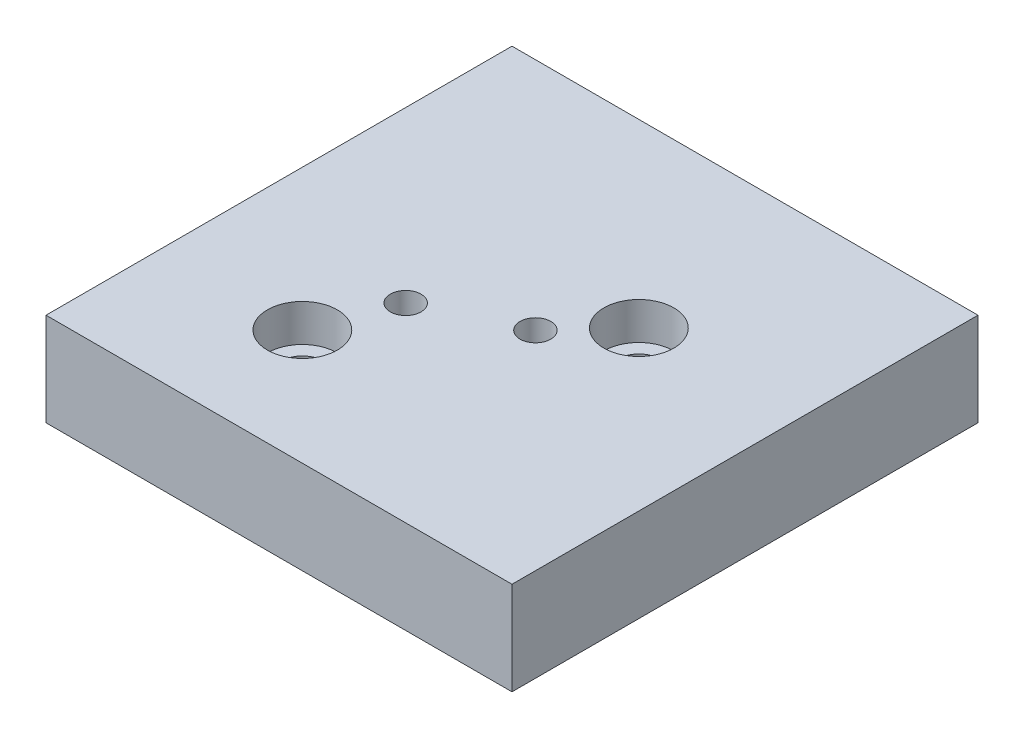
SolidWorks part; units mm, degrees
ref_plane "Vorne" through (0, 0, 0) normal (0, 0, 1) x (1, 0, 0)
ref_plane "Oben" through (0, 0, 0) normal (0, 1, 0) x (1, 0, 0)
ref_plane "Rechts" through (0, 0, 0) normal (1, 0, 0) x (0, 0, -1)
sketch "Skizze1" plane through (0, 0, 0) normal (0, 1, 0) x (1, 0, 0)
  line L1 (0, 0) -> (100, 0)
  line L2 (0, 0) -> (0, 100)
  line L3 (0, 100) -> (100, 100)
  line L4 (100, 0) -> (100, 100)
  dimension "D1" = 100
  dimension "D2" = 100
extrude "Linear austragen1" add sketch "Skizze1" along normal blind 20
hole_wizard "Durchgangsloch für M61" positions "Skizze3" profile "Skizze2" hole size "M6" standard "DIN"
sketch "Skizze3" plane through (0, 20, 0) normal (0, 1, 0) x (-1, 0, 0)
  point P0 (-55.3211, -49.7092)
  point P1 (-36.3268, -40.8565)
sketch "Skizze2" plane through (55.3211, 20, -49.7092) normal (1, 0, 0) x (0, 0, 1)
  line L0 (0, 0) -> (0, 20)
  line L1 (0, 20) -> (3.3, 20)
  line L2 (3.3, 20) -> (3.3, 0)
  line L5 (3.3, 0) -> (0, 0)
  line L11 (0, -6.35) -> (0, 107.95) construction
  dimension "Bohrerdurchmesser" = 6.6
  dimension "Bohrungstiefe" = 20
hole_wizard "Stirnsenkung für M8 Zylinderschraube mit Innensechskant2" positions "Skizze6" profile "Skizze5" counterbore size "M8" standard "DIN"
sketch "Skizze6" plane through (0, 20, 0) normal (0, 1, 0) x (-1, 0, 0)
  point P0 (-30.2529, -24.7592)
sketch "Skizze5" plane through (30.2529, 20, -24.7592) normal (1, 0, 0) x (0, 0, 1)
  line L0 (0, 0) -> (0, 20)
  line L1 (0, 20) -> (4.5, 20)
  line L3 (4.5, 20) -> (4.5, 8)
  line L4 (4.5, 8) -> (7.5, 8)
  line L5 (7.5, 8) -> (7.5, 0)
  line L7 (7.5, 0) -> (0, 0)
  line L11 (0, -6.35) -> (0, 107.95) construction
  dimension "Bohrerdurchmesser" = 9
  dimension "Bohrungstiefe" = 20
  dimension "Senkdurchmesser2" = 15
  dimension "Senktiefe2" = 8
hole_wizard "Stirnsenkung für M8 Zylinderschraube mit Innensechskant3" positions "Skizze9" profile "Skizze8" counterbore size "M8" standard "DIN"
sketch "Skizze9" plane through (0, 20, 0) normal (0, 1, 0) x (-1, 0, 0)
  point P0 (-65.9901, -61.2317)
sketch "Skizze8" plane through (65.9901, 20, -61.2317) normal (1, 0, 0) x (0, 0, 1)
  line L0 (0, 0) -> (0, 15.7039)
  line L1 (0, 15.7039) -> (4.5, 13)
  line L2 (4.5, 13) -> (4.5, 8)
  line L3 (4.5, 8) -> (7.5, 8)
  line L4 (7.5, 8) -> (7.5, 0)
  line L5 (7.5, 0) -> (0, 0)
  line L10 (0, 15.7039) -> (-4.5, 13) construction
  line L11 (0, -6.35) -> (0, 107.95) construction
  dimension "Bohrerdurchmesser" = 9
  dimension "Bohrungstiefe" = 13
  dimension "Senkdurchmesser2" = 15
  dimension "Senktiefe2" = 8
  dimension "Spitzenwinkel" = 118
